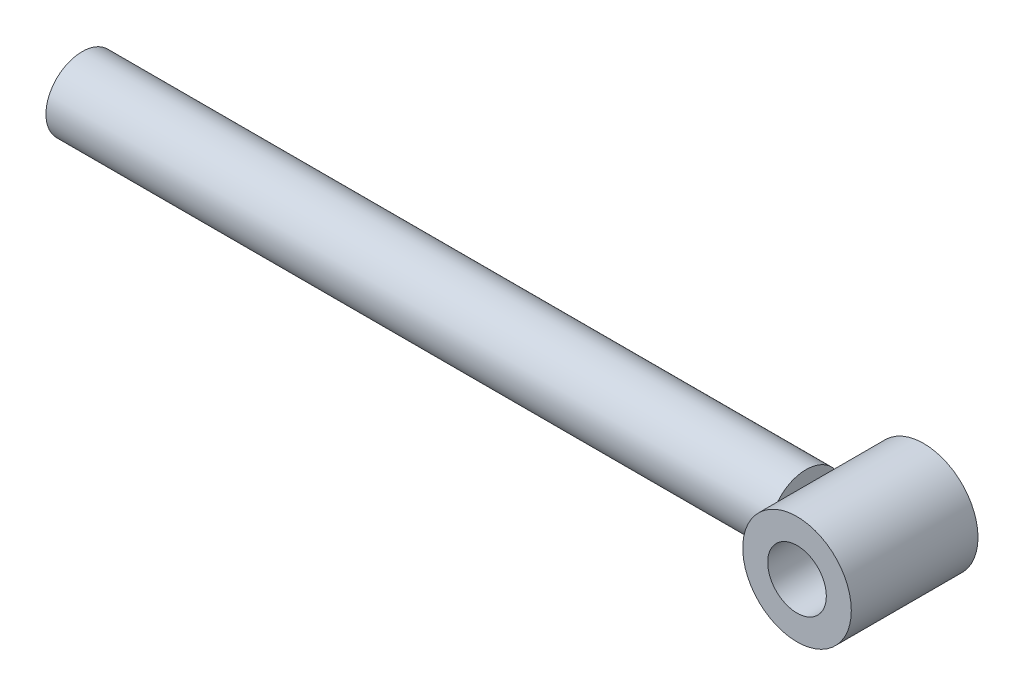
SolidWorks part; units mm, degrees
ref_plane "Plan de face" through (0, 0, 0) normal (0, 0, 1) x (1, 0, 0)
ref_plane "Plan de dessus" through (0, 0, 0) normal (0, 1, 0) x (1, 0, 0)
ref_plane "Plan de droite" through (0, 0, 0) normal (1, 0, 0) x (0, 0, -1)
sketch "Esquisse1" plane through (0, 0, 0) normal (1, 0, 0) x (0, 0, -1)
  circle A0 centre (0, 0) radius 10
  dimension "D1" = 20
extrude "Extrusion1" add sketch "Esquisse1" along normal blind 200
sketch "Esquisse2" plane through (0, 0, 0) normal (0, 0, 1) x (1, 0, 0)
  line L0 (200, -10) -> (200, 10) construction
  circle A0 centre (215, 0) radius 15
  circle A1 centre (215, 0) radius 8.1
  dimension "D1" = 16.2
  dimension "D2" = 30
extrude "Extrusion2" add sketch "Esquisse2" along normal mid plane 35
ref_plane "Plan1" through (187, 0, 0) normal (1, 0, 0) x (0, 0, -1)
